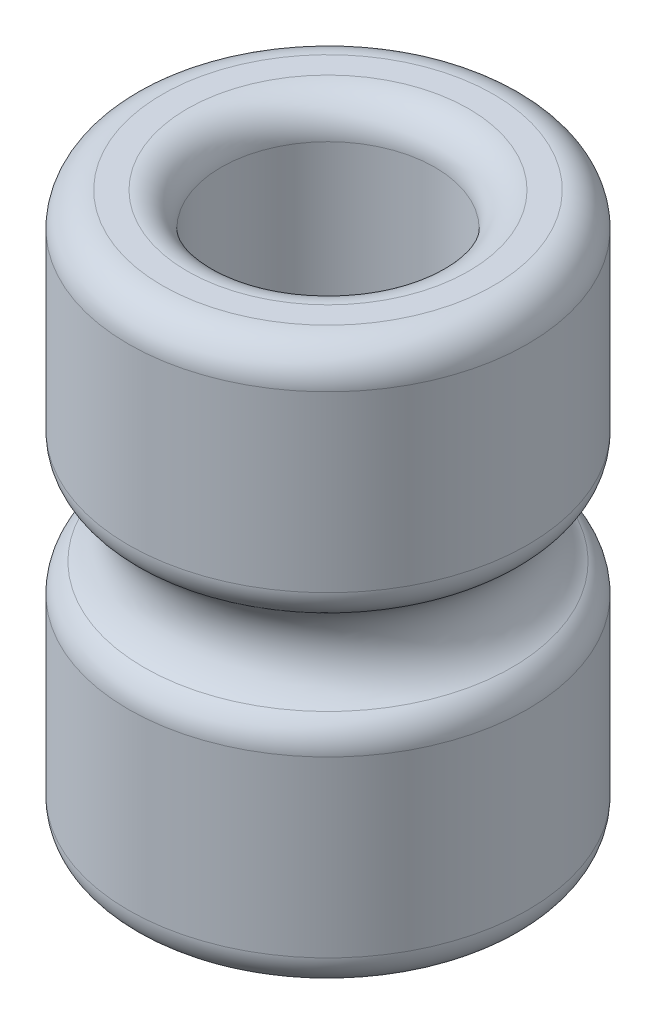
SolidWorks part; units mm, degrees
ref_plane "Front Plane" through (0, 0, 0) normal (0, 0, 1) x (1, 0, 0)
ref_plane "Top Plane" through (0, 0, 0) normal (0, 1, 0) x (1, 0, 0)
ref_plane "Right Plane" through (0, 0, 0) normal (1, 0, 0) x (0, 0, -1)
sketch "Sketch1" plane through (0, 0, 0) normal (0, 0, 1) x (1, 0, 0)
  line L0 (0, 0) -> (0, 50000) construction
  line L1 (0, 0) -> (-50000, 0) construction
  line L2 (0, 4.191) -> (2.9972, 4.191)
  line L3 (2.9972, 4.191) -> (2.9972, -4.191)
  line L4 (0, -4.191) -> (2.9972, -4.191)
  line L5 (0, 4.191) -> (0, -4.191)
  point P9 (2.9972, 0)
  dimension "D1" = 5.9944
  dimension "D2" = 8.382
revolve "Revolve1" add sketch "Sketch1" angle 360 about L0
sketch "Sketch2" plane through (0, 4.191, 0) normal (0, 1, 0) x (1, 0, 0)
  circle A0 centre (0, 0) radius 1.6065
  circle A1 centre (0, 0) radius 2.9972 construction
  dimension "D2" = 3.2131
extrude "Cut-Extrude1" cut sketch "Sketch2" against normal through all
sketch "Sketch3" plane through (0, 0, 0) normal (0, 0, 1) x (1, 0, 0)
  line L0 (0, 0) -> (0, 50000) construction
  line L1 (0, 0) -> (50000, 0) construction
  circle A0 centre (3.175, 0) radius 0.762
  dimension "D1" = 1.524
  dimension "D2" = 4.826
revolve "Cut-Revolve1" cut sketch "Sketch3" angle 360 about L0
fillet "Fillet1" radius 0.508 6 edges at (0, -0.741, 2.9972) (0, 0.741, -2.9972) (0, 4.191, 1.6065) (0, -4.191, -2.9972) (0, -4.191, 1.6065) (0, 4.191, -2.9972)
